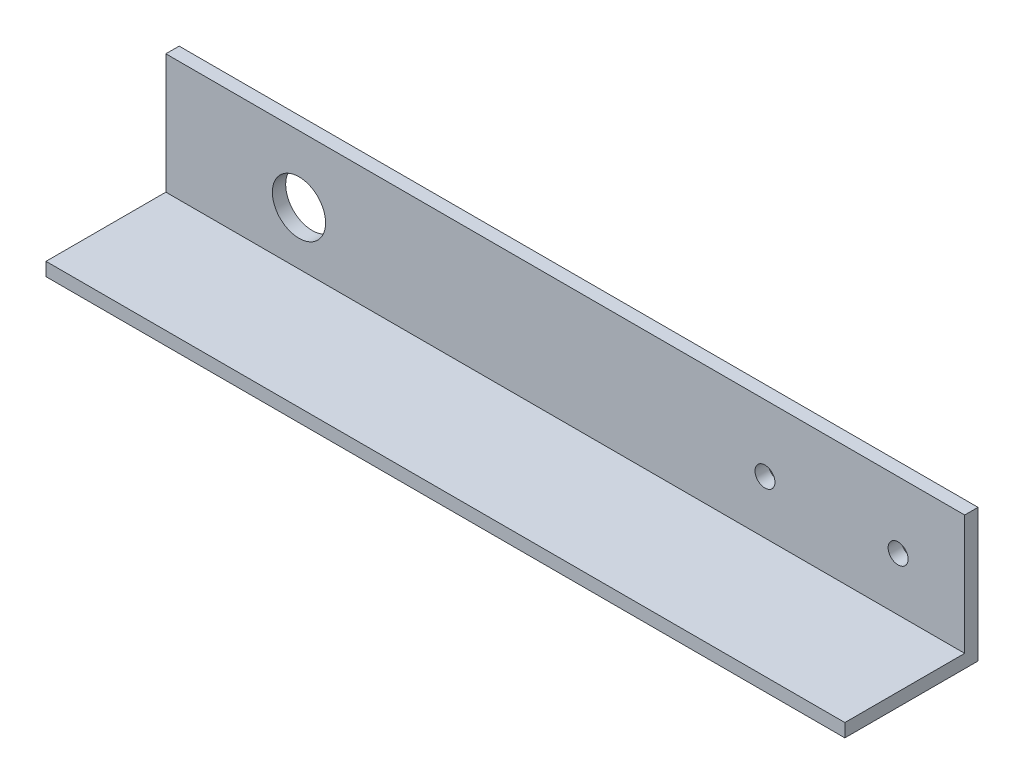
SolidWorks part; units mm, degrees
ref_plane "正面" through (0, 0, 0) normal (0, 0, 1) x (1, 0, 0)
ref_plane "平面" through (0, 0, 0) normal (0, 1, 0) x (1, 0, 0)
ref_plane "右側面" through (0, 0, 0) normal (1, 0, 0) x (0, 0, -1)
sketch "ｽｹｯﾁ1" plane through (0, 0, 0) normal (1, 0, 0) x (0, 0, -1)
  line L0 (0, 0) -> (0, 20)
  line L1 (-2, 20) -> (-2, 2)
  line L2 (-2, 2) -> (-20, 2)
  line L3 (-20, 2) -> (-20, 0)
  line L4 (-20, 0) -> (0, 0)
  line L5 (0, 20) -> (-2, 20)
  dimension "D1" = 20
  dimension "D2" = 20
  dimension "D3" = 2
  dimension "D4" = 2
extrude "押し出し1" add sketch "ｽｹｯﾁ1" along normal blind 120
sketch "ｽｹｯﾁ3" plane through (0, 0, 0) normal (0, 0, -1) x (-1, 0, 0)
  line L0 (0, 10) -> (-20, 10) construction
  line L1 (0, 0) -> (0, 20) construction
  circle A0 centre (-20, 10) radius 4
  dimension "D2" = 8
  dimension "D1" = 20
extrude "押し出し2" cut sketch "ｽｹｯﾁ3" against normal through all
sketch "ｽｹｯﾁ4" plane through (0, 0, 0) normal (0, 0, -1) x (-1, 0, 0)
  line L0 (-120, 10) -> (-90, 10) construction
  line L1 (-120, 0) -> (-120, 20) construction
  circle A0 centre (-90, 10) radius 1.5
  dimension "D2" = 3
  dimension "D1" = 30
extrude "押し出し3" cut sketch "ｽｹｯﾁ4" against normal through all
sketch "ｽｹｯﾁ5" plane through (0, 0, 0) normal (0, 0, -1) x (-1, 0, 0)
  line L0 (-120, 10) -> (-110, 10) construction
  line L1 (-120, 0) -> (-120, 20) construction
  circle A0 centre (-110, 10) radius 1.5
  dimension "D2" = 3
  dimension "D1" = 10
extrude "押し出し4" cut sketch "ｽｹｯﾁ5" against normal through all
